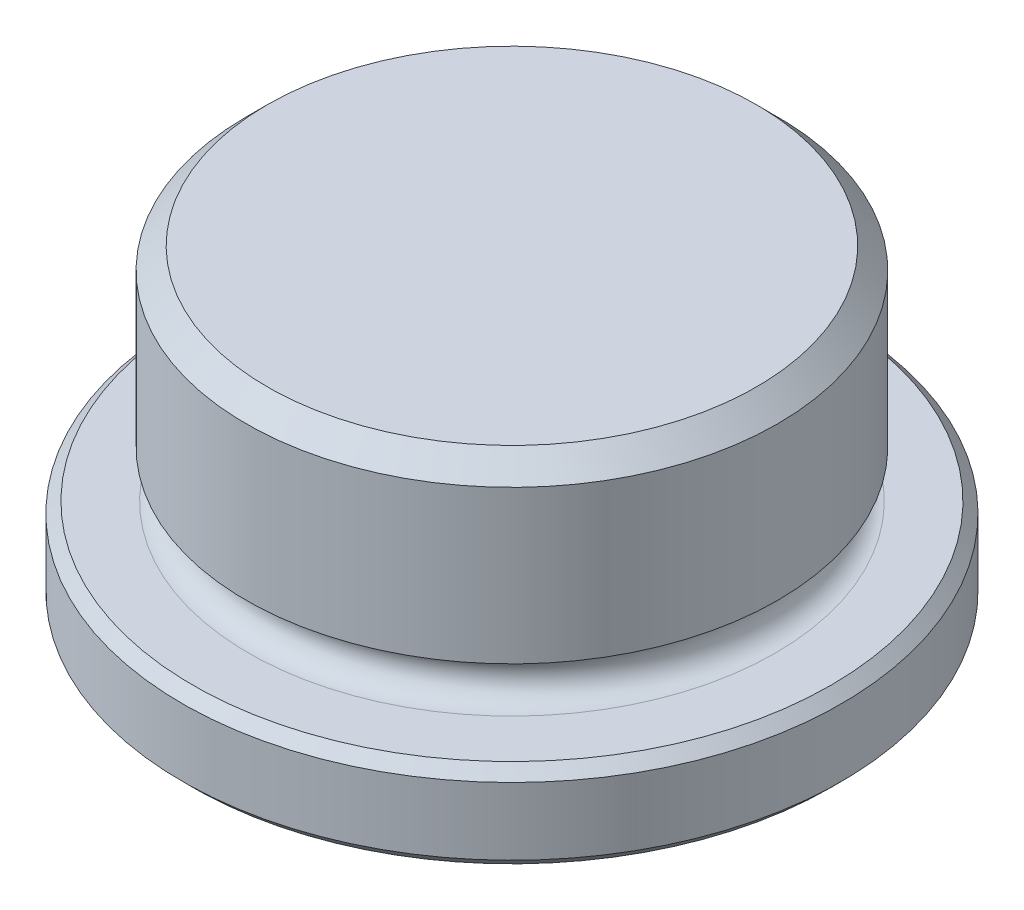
SolidWorks part; units mm, degrees
ref_plane "Front Plane" through (0, 0, 0) normal (0, 0, 1) x (1, 0, 0)
ref_plane "Top Plane" through (0, 0, 0) normal (0, 1, 0) x (1, 0, 0)
ref_plane "Right Plane" through (0, 0, 0) normal (1, 0, 0) x (0, 0, -1)
sketch "Sketch1" plane through (0, 0, 0) normal (0, 0, 1) x (1, 0, 0)
  line L0 (0, 0) -> (11.43, 0)
  line L1 (11.811, 0.381) -> (11.811, 2.794)
  line L2 (11.43, 3.175) -> (9.436, 3.175)
  line L3 (9.525, 4.8587) -> (9.525, 10.3378)
  line L4 (8.763, 11.0998) -> (0, 11.0998)
  line L5 (0, 11.0998) -> (0, 0)
  line L6 (0, -6.2671) -> (0, 6.2671) construction
  line L7 (12.9921, 0) -> (-12.9921, 0) construction
  line L8 (11.43, 0) -> (11.811, 0.381)
  line L9 (11.811, 2.794) -> (11.43, 3.175)
  line L10 (9.525, 10.3378) -> (8.763, 11.0998)
  line L12 (9.1624, 4.7268) -> (9.525, 4.8587)
  arc A1 (9.436, 3.175) -> (9.1624, 4.7268) centre (9.436, 3.975) cw
  point P1 (11.811, 0)
  point P3 (11.811, 3.175)
  point P6 (9.525, 11.0998)
  dimension "D5" = 1.6837
  dimension "D6" = 0.8
  dimension "D7" = 8.636
  dimension "D1" = 11.811
  dimension "D2" = 11.0998
  dimension "D3" = 3.175
  dimension "D4" = 9.525
  dimension "D11" = 20
revolve "Revolve1" add sketch "Sketch1" angle 360 about L5
sketch "Sketch2" plane through (0, 0, 0) normal (0, -1, 0) x (1, 0, 0)
  line L1 (-2.7496, 4.7625) -> (-5.4993, 0)
  line L2 (-5.4993, 0) -> (-2.7496, -4.7625)
  line L3 (-2.7496, -4.7625) -> (2.7496, -4.7625)
  line L4 (2.7496, -4.7625) -> (5.4993, 0)
  line L5 (5.4993, 0) -> (2.7496, 4.7625)
  line L6 (2.7496, 4.7625) -> (-2.7496, 4.7625)
  circle A0 centre (0, 0) radius 4.7625 construction
  dimension "D1" = 9.525
extrude "Cut-Extrude1" cut sketch "Sketch2" against normal blind 7.874
sketch "Sketch8" plane through (0, 0, 0) normal (0, 0, 1) x (1, 0, 0)
  line L0 (-5.7533, 0) -> (-2.0498, 3.7035)
  line L1 (-11.43, 0) -> (11.43, 0) construction
  line L3 (-2.0498, 3.7035) -> (0, 3.7035)
  line L4 (0, 3.7035) -> (0, 0)
  line L5 (0, 0) -> (-5.7533, 0)
  line L7 (-5.4993, 7.874) -> (-5.4993, 0) construction
  line L8 (0, 3.7035) -> (0, -0.942) construction
  dimension "D1" = 45
  dimension "D2" = 0.254
  dimension "D3" = 3.7035
revolve "Cut-Revolve1" cut sketch "Sketch8" angle 360 about L8
